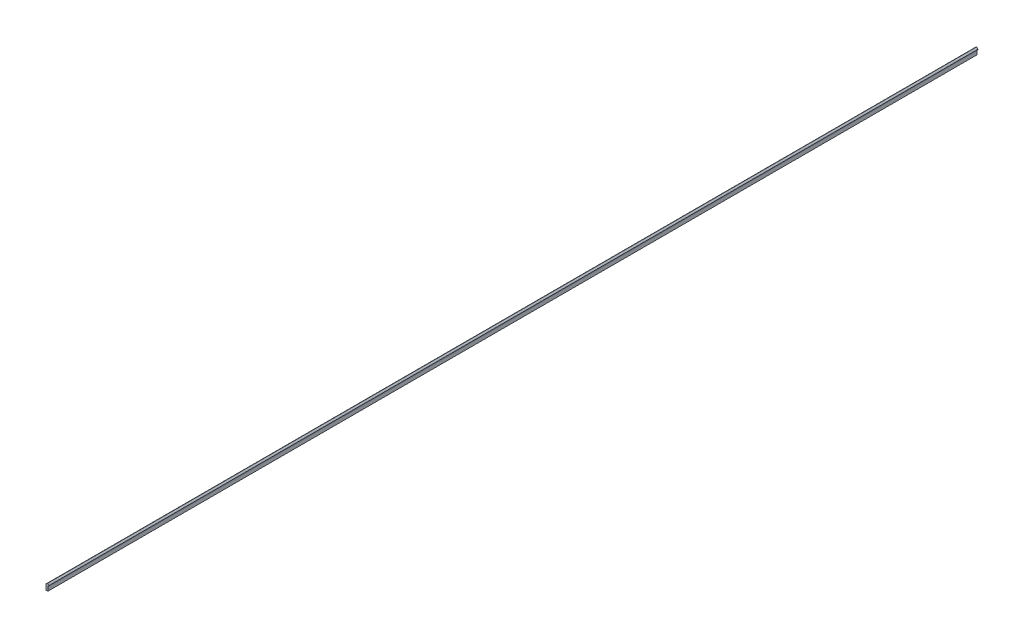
SolidWorks part; units mm, degrees
ref_plane "Plan de face" through (0, 0, 0) normal (0, 0, 1) x (1, 0, 0)
ref_plane "Plan de dessus" through (0, 0, 0) normal (0, 1, 0) x (1, 0, 0)
ref_plane "Plan de droite" through (0, 0, 0) normal (1, 0, 0) x (0, 0, -1)
sketch "Esquisse1" plane through (0, 0, 0) normal (0, 0, 1) x (1, 0, 0)
  line L0 (0, 11.825) -> (3.175, 15)
  line L1 (3.175, 15) -> (6.35, 11.825)
  line L2 (6.35, 11.825) -> (6.35, 10.3998)
  line L3 (3.99, 10.3998) -> (3.99, 0)
  line L4 (3.99, 0) -> (0, 0)
  line L5 (0, 0) -> (0, 11.825)
  line L6 (6.35, 10.3998) -> (3.99, 10.3998)
  dimension "D1" = 15
  dimension "D2" = 3.175
  dimension "D3" = 2.36
extrude "Boss.-Extru.1" add sketch "Esquisse1" along normal blind 2000
fillet "Congé1" radius 0.5 1 edges at (3.175, 15, 1000)
